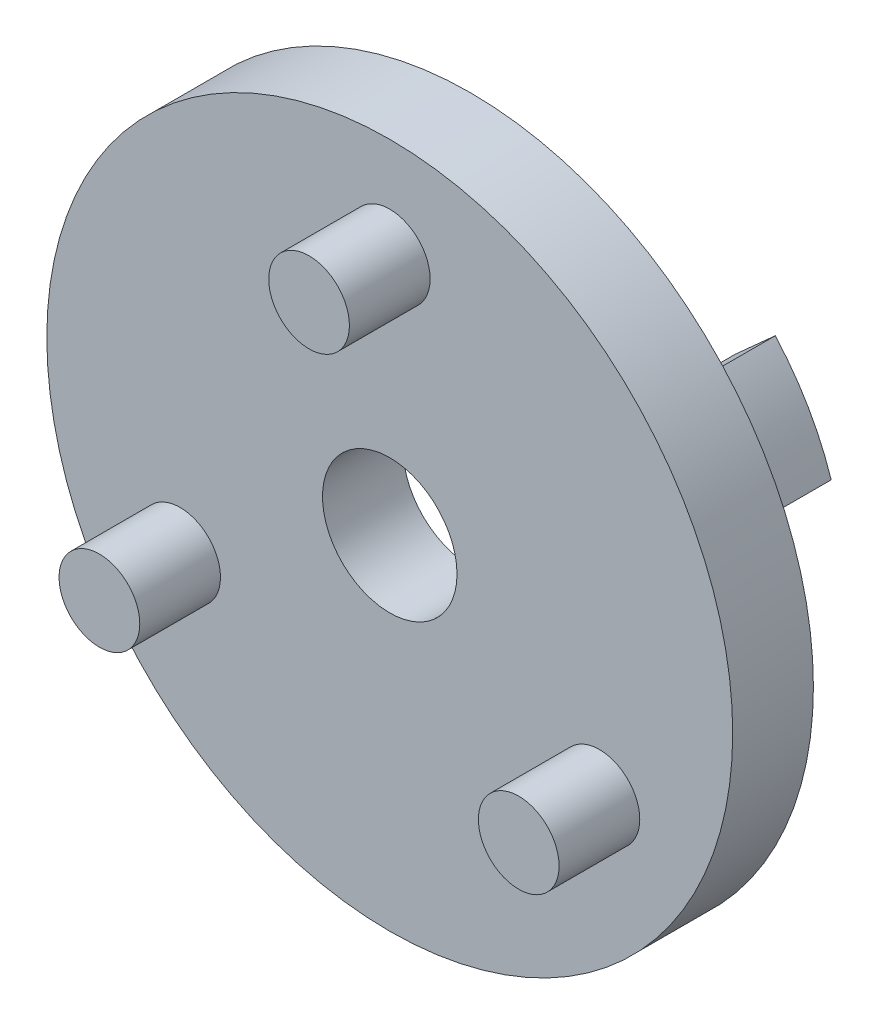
SolidWorks part; units mm, degrees
ref_plane "Plan de face" through (0, 0, 0) normal (0, 0, 1) x (1, 0, 0)
ref_plane "Plan de dessus" through (0, 0, 0) normal (0, 1, 0) x (1, 0, 0)
ref_plane "Plan de droite" through (0, 0, 0) normal (1, 0, 0) x (0, 0, -1)
sketch "Esquisse1" plane through (0, 0, 0) normal (0, 0, 1) x (1, 0, 0)
  circle A0 centre (0, 0) radius 12.75
  circle A1 centre (0, 0) radius 2.5
  dimension "D1" = 25.5
  dimension "D2" = 5
extrude "Extrusion1" add sketch "Esquisse1" along normal blind 3
sketch "Esquisse2" plane through (0, 0, 3) normal (0, 0, 1) x (1, 0, 0)
  line L0 (0, 0) -> (0, 13.853) construction
  circle A0 centre (0, 9) radius 1.5
  circle A1 centre (0, 0) radius 9 construction
  circle A2 centre (7.7942, -4.5) radius 1.5
  circle A3 centre (-7.7942, -4.5) radius 1.5
  dimension "D1" = 3
  dimension "D2" = 18
extrude "Extrusion2" add sketch "Esquisse2" along normal blind 3
sketch "Esquisse3" plane through (0, 0, 0) normal (0, 0, -1) x (-1, 0, 0)
  line L0 (0, 0) -> (-14.4265, 8.3291) construction
  line L1 (0, 0) -> (-19.551, 0) construction
  line L2 (-7.6085, 2.4721) -> (-9.5106, 3.0902)
  line L3 (-5.9452, 5.353) -> (-7.4314, 6.6913)
  line L4 (7.5896, 2.4772) -> (9.4918, 3.0952)
  line L5 (5.9264, 5.3581) -> (7.4126, 6.6963)
  line L6 (-1.6683, -7.8064) -> (-2.0842, -9.7627)
  line L7 (1.6583, -7.8064) -> (2.0741, -9.7627)
  arc A0 (-7.4314, 6.6913) -> (-9.5106, 3.0902) centre (0, 0) ccw
  arc A1 (-5.9452, 5.353) -> (-7.6085, 2.4721) centre (0, 0) ccw
  arc A2 (7.5896, 2.4772) -> (5.9264, 5.3581) centre (-0.0188, 0.005) ccw
  arc A3 (9.4918, 3.0952) -> (7.4126, 6.6963) centre (-0.0188, 0.005) ccw
  arc A4 (-1.6683, -7.8064) -> (1.6583, -7.8064) centre (-0.005, 0.0188) ccw
  arc A5 (-2.0842, -9.7627) -> (2.0741, -9.7627) centre (-0.005, 0.0188) ccw
  dimension "D1" = 20
  dimension "D2" = 16
  dimension "D3" = 30
  dimension "D4" = 12
  dimension "D5" = 12
  dimension "D6" = 2
  dimension "D7" = 2
extrude "Extrusion3" add sketch "Esquisse3" along normal blind 3.9
